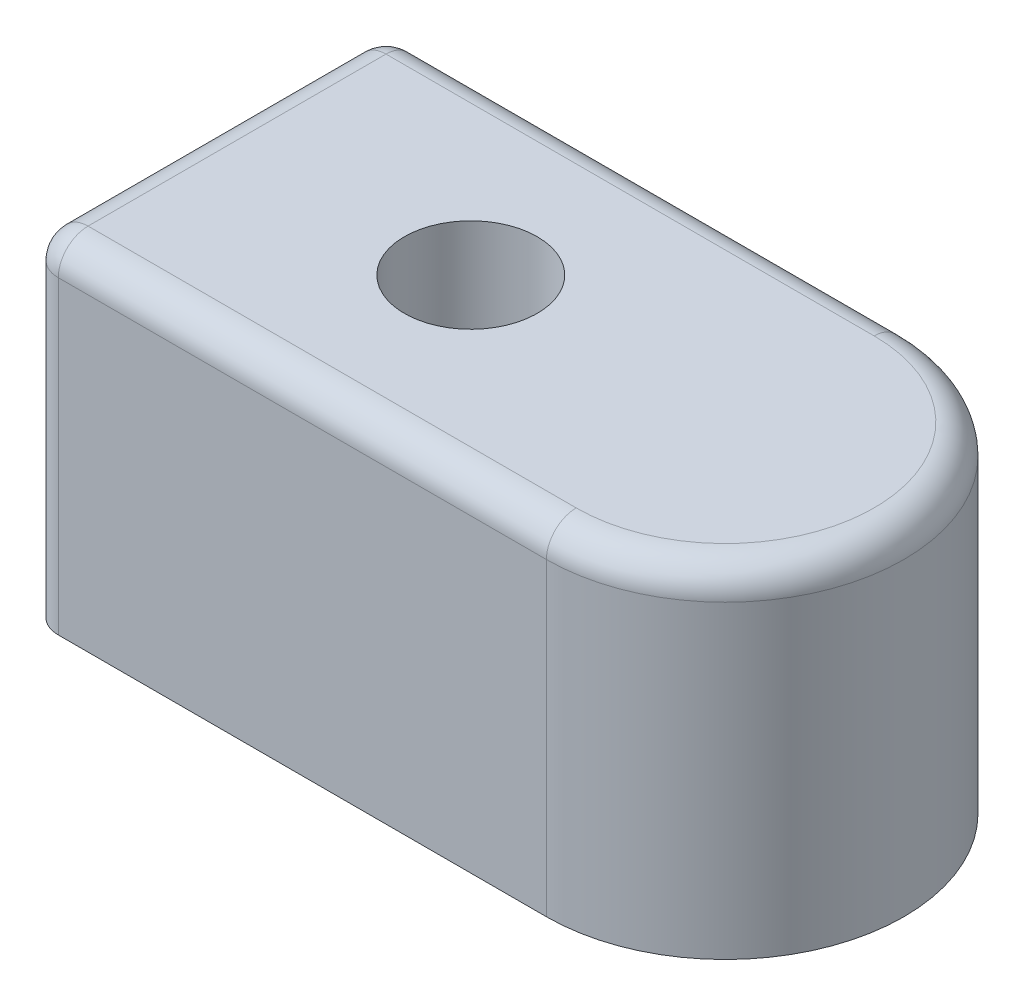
SolidWorks part; units mm, degrees
ref_plane "Front Plane" through (0, 0, 0) normal (0, 0, 1) x (1, 0, 0)
ref_plane "Top Plane" through (0, 0, 0) normal (0, 1, 0) x (1, 0, 0)
ref_plane "Right Plane" through (0, 0, 0) normal (1, 0, 0) x (0, 0, -1)
sketch "Sketch2" plane through (0, 0, 0) normal (0, 1, 0) x (1, 0, 0)
  line L0 (0, 0) -> (48.006, 0) construction
  line L1 (0, 0) -> (-29.21, 0) construction
  line L2 (0, 0) -> (0, 19.812) construction
  line L3 (0, 19.812) -> (-29.21, 19.812)
  line L4 (-29.21, 19.812) -> (-29.21, -19.812)
  line L5 (28.194, 0) -> (28.194, 19.812) construction
  line L6 (28.194, 19.812) -> (0, 19.812)
  line L7 (28.194, -19.812) -> (0, -19.812)
  line L8 (0, -19.812) -> (-29.21, -19.812)
  arc A0 (28.194, -19.812) -> (28.194, 19.812) centre (28.194, 0) ccw
  dimension "D1" = 29.21
  dimension "D2" = 19.812
  dimension "D3" = 48.006
  dimension "D4" = 19.812
extrude "body" add sketch "Sketch2" along normal blind 37.592
sketch "Sketch3" plane through (0, 0, 0) normal (0, -1, 0) x (1, 0, 0)
  circle A0 centre (0, 0) radius 7.366
  dimension "D1" = 14.732
extrude "hole" cut sketch "Sketch3" against normal through all
fillet "Fillet2" radius 3.302 4 edges at (48.006, 37.592, 0) (-0.508, 37.592, 19.812) (-29.21, 37.592, 0) (-0.508, 37.592, -19.812)
fillet "Fillet3" radius 3.302 4 edges at (-28.2429, 36.6249, 18.8449) (-28.2429, 36.6249, -18.8449) (-29.21, 17.145, 19.812) (-29.21, 17.145, -19.812)
